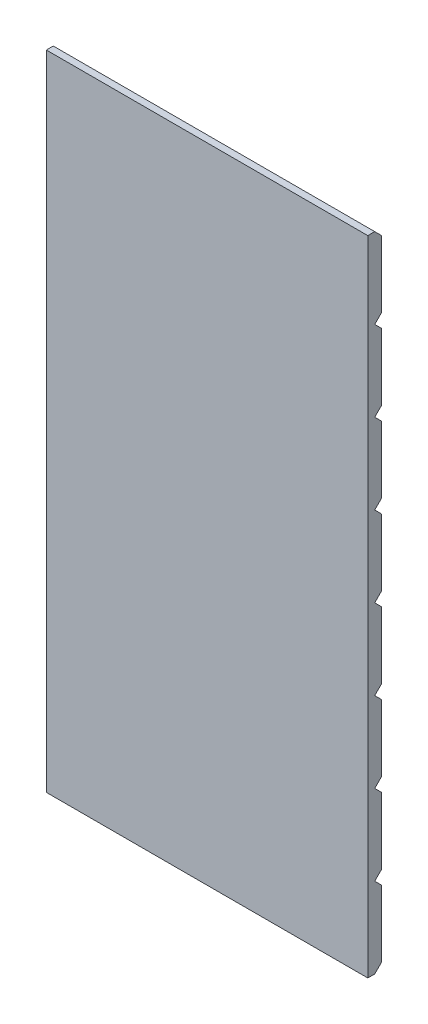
SolidWorks part; units mm, degrees
ref_plane "Front Plane" through (0, 0, 0) normal (0, 0, 1) x (1, 0, 0)
ref_plane "Top Plane" through (0, 0, 0) normal (0, 1, 0) x (1, 0, 0)
ref_plane "Right Plane" through (0, 0, 0) normal (1, 0, 0) x (0, 0, -1)
sketch "Sketch1" plane through (0, 0, 0) normal (0, 0, 1) x (1, 0, 0)
  line L1 (-290, 580) -> (290, 580)
  line L2 (-290, 580) -> (-290, -580)
  line L3 (-290, -580) -> (290, -580)
  line L4 (290, 580) -> (290, -580)
  point P4 (-290, 0)
  point P6 (0, 580)
  dimension "D1" = 580
  dimension "D2" = 1160
extrude "Boss-Extrude1" add sketch "Sketch1" along normal blind 25
sketch "Sketch4" plane through (290, 0, 0) normal (1, 0, 0) x (0, 0, -1)
  line L0 (-12.5, 580) -> (48.5815, 641.0815)
  line L2 (48.5815, 641.0815) -> (48.5815, 518.9185)
  line L3 (48.5815, 518.9185) -> (-12.5, 580)
  line L4 (-25, 580) -> (0, 580) construction
  line L5 (-25, 580) -> (0, 580) construction
  point P4 (-12.5, 580)
  dimension "D1" = 90
  dimension "D2" = 122.1629
extrude "Cut-Extrude2" cut sketch "Sketch4" against normal up to surface (580 mm away)
pattern_linear "LPattern2" count 9 spacing 145 along (0, -0.7071, 0.7071) of "Cut-Extrude2"
